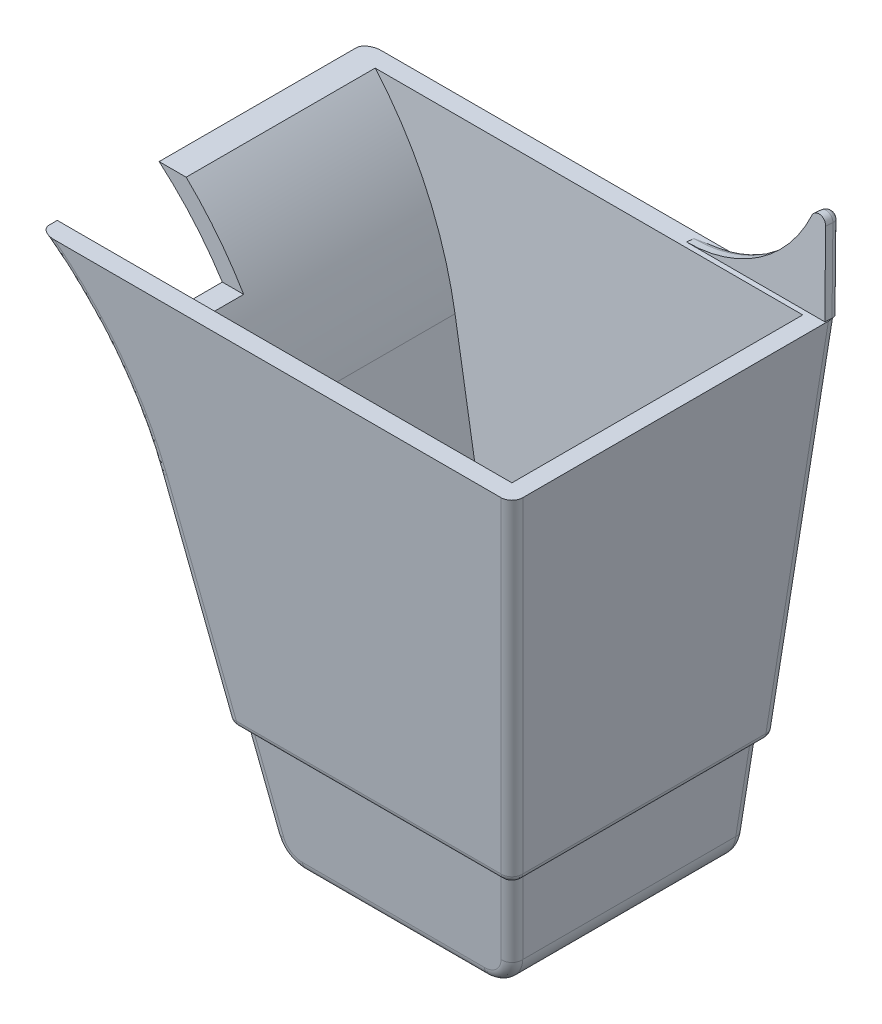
SolidWorks part; units mm, degrees
ref_plane "Plan de face" through (0, 0, 0) normal (0, 0, 1) x (1, 0, 0)
ref_plane "Plan de dessus" through (0, 0, 0) normal (0, 1, 0) x (1, 0, 0)
ref_plane "Plan de droite" through (0, 0, 0) normal (1, 0, 0) x (0, 0, -1)
sketch "Esquisse1" plane through (0, 0, 0) normal (0, 0, 1) x (1, 0, 0)
  line L0 (0.6389, 7.3028) -> (2.6247, 30)
  line L1 (-7.3306, 0) -> (-57.3306, 0)
  line L2 (13.3735, 130) -> (-116.6265, 130)
  line L3 (-65.0581, 5.9294) -> (-71.5077, 30)
  line L4 (0.6389, 7.3028) -> (2.6247, 30) construction
  line L5 (2.6247, 130) -> (2.6247, 30) construction
  line L6 (-73.5077, 30) -> (-71.5077, 30)
  line L7 (2.6247, 30) -> (4.6247, 30)
  line L8 (13.3735, 130) -> (4.6247, 30)
  line L9 (-88.2449, 85) -> (-73.5077, 30)
  arc A0 (-88.2449, 85) -> (-116.6265, 130) centre (-174.9438, 61.7691) ccw
  arc A1 (-57.3306, 0) -> (-65.0581, 5.9294) centre (-57.3306, 8) cw
  arc A2 (0.6389, 7.3028) -> (-7.3306, 0) centre (-7.3306, 8) cw
  point P11 (0, 0)
  point P20 (-73.5077, 30)
  point P23 (-71.5077, 30)
  point P26 (2.6247, 30)
  point P29 (4.6247, 30)
  dimension "D2" = 8
  dimension "D1" = 130
  dimension "D3" = 50
  dimension "D4" = 130
  dimension "D5" = 5
  dimension "D6" = 15
  dimension "D7" = 85
  dimension "D8" = 30
  dimension "D9" = 2
  dimension "D10" = 2
  dimension "D11" = 5
  dimension "D12" = 15
extrude "Boss.-Extru.1" add sketch "Esquisse1" along normal blind 90
sketch "Esquisse2" plane through (0, 0, 0) normal (1, 0, 0) x (0, 0, -1)
  line L0 (-13.3735, 0) -> (-10.7489, 30)
  line L1 (-90, 0) -> (0, 0) construction
  line L2 (-10.7489, 30) -> (-8.7489, 30)
  line L3 (-90, 30) -> (0, 30) construction
  line L4 (0, 130) -> (-8.7489, 30)
  line L5 (-45, 130) -> (-45, -22.2091) construction
  line L6 (-90, 130) -> (0, 130) construction
  line L7 (0, 30) -> (0, 130) construction
  line L8 (0, 130) -> (-90, 130)
  line L9 (-13.3735, 0) -> (-76.6265, 0)
  line L10 (-90, 130) -> (-81.2511, 30)
  line L11 (-79.2511, 30) -> (-81.2511, 30)
  line L12 (-76.6265, 0) -> (-79.2511, 30)
  point P0 (-76.6265, 0)
  point P17 (-45, 0)
  point P25 (-13.3735, 0)
  point P36 (-45, 0)
  dimension "D1" = 5
  dimension "D2" = 2
extrude "Enlèv. mat.-Extru.1" cut sketch "Esquisse2" against normal through all and the other way through all flip side to cut
shell "Coque8" thickness 5
sketch "Esquisse4" plane through (0, 0, 0) normal (0, -1, 0) x (1, 0, 0)
  line L0 (-27.3306, 51.6265) -> (-52.3306, 51.6265)
  line L1 (-27.3306, 64.6265) -> (-52.3306, 64.6265)
  line L4 (-57.3306, 76.6265) -> (-7.3306, 76.6265) construction
  line L5 (-57.3306, 76.6265) -> (-57.3306, 13.3735) construction
  arc A0 (-27.3306, 51.6265) -> (-27.3306, 64.6265) centre (-27.3306, 58.1265) ccw
  arc A1 (-52.3306, 64.6265) -> (-52.3306, 51.6265) centre (-52.3306, 58.1265) ccw
  dimension "D1" = 6.5
  dimension "D2" = 25
  dimension "D3" = 12
  dimension "D4" = 5
extrude "Enlèv. mat.-Extru.3" cut sketch "Esquisse4" against normal blind 23
sketch "Esquisse5" plane through (0, 5, 0) normal (0, 1, 0) x (1, 0, 0)
  line L0 (-52.3306, -64.6265) -> (-27.3306, -64.6265) construction
  line L1 (-27.3306, -51.6265) -> (-52.3306, -51.6265) construction
  line L2 (-52.3306, -64.6265) -> (-27.3306, -64.6265)
  line L3 (-27.3306, -51.6265) -> (-52.3306, -51.6265)
  arc A3 (-27.3306, -64.6265) -> (-27.3306, -51.6265) centre (-27.3306, -58.1265) ccw construction
  arc A4 (-52.3306, -51.6265) -> (-57.3306, -53.9732) centre (-52.3306, -58.1265) ccw construction
  arc A5 (-57.3306, -53.9732) -> (-57.3306, -62.2798) centre (-52.3306, -58.1265) ccw construction
  arc A6 (-52.3306, -51.6265) -> (-57.3306, -53.9732) centre (-52.3306, -58.1265) ccw
  arc A7 (-27.3306, -64.6265) -> (-27.3306, -51.6265) centre (-27.3306, -58.1265) ccw
  arc A8 (-57.3306, -53.9732) -> (-57.3306, -62.2798) centre (-52.3306, -58.1265) ccw
  arc A9 (-57.3306, -62.2798) -> (-52.3306, -64.6265) centre (-52.3306, -58.1265) ccw construction
  arc A10 (-57.3306, -62.2798) -> (-52.3306, -64.6265) centre (-52.3306, -58.1265) ccw
extrude "Extru.-Mince1" add sketch "Esquisse5" along normal blind 23 thin
sketch "Esquisse6" plane through (0, 28, 0) normal (0, 1, 0) x (1, 0, 0)
  line L2 (-52.3306, -67.6265) -> (-27.3306, -67.6265)
  line L3 (-27.3306, -48.6265) -> (-52.3306, -48.6265)
  line L4 (-52.3306, -67.6265) -> (-27.3306, -67.6265)
  line L5 (-27.3306, -48.6265) -> (-52.3306, -48.6265)
  arc A2 (-52.3306, -48.6265) -> (-52.3306, -67.6265) centre (-52.3306, -58.1265) ccw
  arc A3 (-52.3306, -48.6265) -> (-52.3306, -67.6265) centre (-52.3306, -58.1265) ccw
  arc A4 (-27.3306, -67.6265) -> (-27.3306, -48.6265) centre (-27.3306, -58.1265) ccw
  arc A5 (-27.3306, -67.6265) -> (-27.3306, -48.6265) centre (-27.3306, -58.1265) ccw
  dimension "D1" = 0
extrude "Boss.-Extru.2" add sketch "Esquisse6" along normal blind 3
fillet "Congé8" radius 6 4 edges at (-61.8306, 31, 58.1265) (-39.8306, 31, 67.6265) (-39.8306, 31, 48.6265) (-17.8306, 31, 58.1265)
fillet "Congé9" radius 2 4 edges at (-67.6711, 35, 45) (-34.8141, 35, 74.6695) (-34.8141, 35, 15.3305) (-1.957, 35, 45)
fillet "Congé10" radius 3 16 edges at (-99.0249, 109.6512, 1.7803) (-80.8763, 57.5, 6.3429) (-68.2829, 17.9647, 11.8018) (-62.2007, 1.6532, 13.2289) (-32.3306, 0, 13.3735) (-1.9259, 2.1018, 13.1896) (1.6318, 18.6514, 11.7417) (8.9991, 80, 4.3744) (-99.0249, 109.6512, 88.2197) (-80.8763, 57.5, 83.6571) (-68.2829, 17.9647, 78.1982) (-62.2007, 1.6532, 76.7711) (-32.3306, 0, 76.6265) (-1.9259, 2.1018, 76.8104) (1.6318, 18.6514, 78.2583) (8.9991, 80, 85.6256)
fillet "Congé11" radius 2 14 edges at (-55.0923, 0, 64.0106) (-55.0923, 0, 52.2423) (-39.8306, 0, 64.6265) (-20.8306, 0, 58.1265) (-39.8306, 0, 51.6265) (3.7507, 30, 9.6228) (4.6247, 30, 45) (3.7507, 30, 80.3772) (-72.6227, 30, 80.393) (-34.4179, 30, 81.2511) (-34.4179, 30, 8.7489) (-72.6227, 30, 9.607) (-73.5077, 30, 45) (-58.8291, 0.1416, 57.9864)
sketch "Esquisse7" plane through (0, 0, 0) normal (1, 0, 0) x (0, 0, -1)
  line L0 (-87.0114, 130) -> (-2.9886, 130) construction
  line L1 (-84.9809, 130) -> (-56.9809, 130)
  line L2 (-84.9809, 130) -> (-83.2311, 110)
  line L3 (-83.2311, 110) -> (-56.9809, 110)
  line L4 (-56.9809, 130) -> (-56.9809, 110)
  line L5 (-81.4109, 31.8257) -> (-90, 130) construction
  line L6 (-81.1571, 86.2941) -> (-84.9809, 130) construction
  dimension "D1" = 20
  dimension "D2" = 28
extrude "Enlèv. mat.-Extru.4" cut sketch "Esquisse7" against normal through all
sketch "Esquisse8" plane through (0, 0.9875, 11.2871) normal (0, -0.0872, -0.9962) x (-1, 0, 0)
  line L0 (24.6265, 129.5053) -> (-13.3735, 129.5053)
  line L2 (-13.3735, 129.5053) -> (-11.772, 150.6563)
  line L3 (-13.3735, 121.9218) -> (-13.3735, 129.2448) construction
  line L4 (-13.3735, 129.5053) -> (-13.3735, 166.7205) construction
  line L5 (-10.3849, 129.5053) -> (112.3922, 129.5053) construction
  arc A0 (-7.9296, 151.2698) -> (24.6265, 129.5053) centre (24.6265, 164.7368) ccw
  arc A1 (-7.9296, 151.2698) -> (-11.772, 150.6563) centre (-9.7777, 150.5053) ccw
  dimension "D1" = 2
  dimension "D2" = 21
  dimension "D3" = 38
extrude "Boss.-Extru.3" add sketch "Esquisse8" against normal blind 4 separate body
fillet "Congé12" radius 2 3 edges at (-5.0459, 135.9196, -0.5179) (10.0931, 152.8876, -2.0024) (12.5728, 140.5353, -0.9217)
